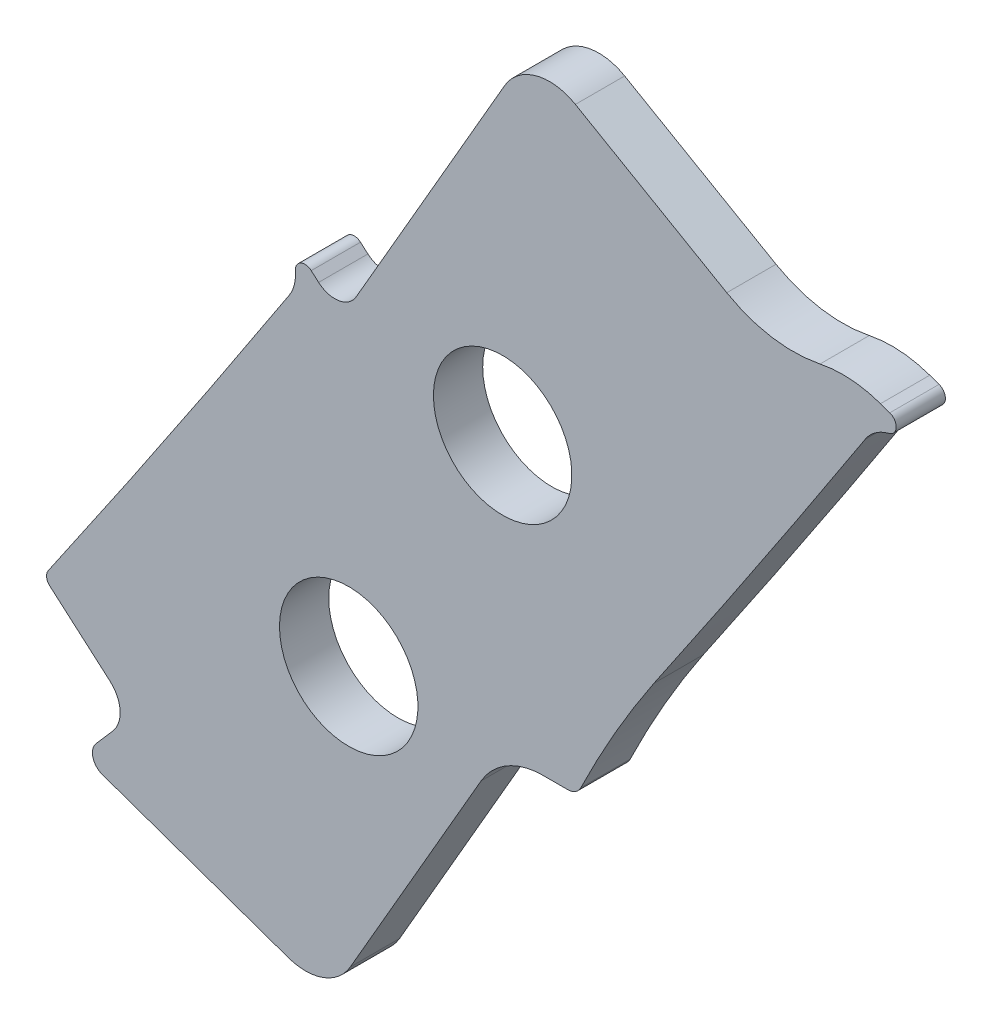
SolidWorks part; units mm, degrees
ref_plane "Front" through (0, 0, 0) normal (0, 0, 1) x (1, 0, 0)
ref_plane "Top" through (0, 0, 0) normal (0, 1, 0) x (1, 0, 0)
ref_plane "Right" through (0, 0, 0) normal (1, 0, 0) x (0, 0, -1)
sketch "Sketch1" plane through (0, 0, 0) normal (0, 0, 1) x (1, 0, 0)
  line L18 (-1062.7125, 28.4504) -> (-1063.1916, 28.6192)
  line L19 (-1071.1191, 29.6103) -> (-1078.9233, 34.116)
  line L20 (-1082.5664, 33.1398) -> (-1090.2276, 19.8704)
  line L21 (-1092.1626, 19.5486) -> (-1092.5453, 19.8827)
  line L22 (-1106.0208, -0.9414) -> (-1102.9205, -3.6338)
  line L23 (-1102.7691, -5.7838) -> (-1103.6391, -6.7855)
  line L24 (-1103.3171, -8.0038) -> (-1093.7255, -11.3845)
  line L25 (-1090.5293, -10.2027) -> (-1083.7857, 1.4776)
  line L26 (-1080.5961, 3.3191) -> (-1079.3261, 3.3191)
  line L27 (-1062.7125, 28.4504) -> (-1063.1916, 28.6192)
  line L28 (-1071.1191, 29.6103) -> (-1078.9233, 34.116)
  line L29 (-1082.5664, 33.1398) -> (-1090.2276, 19.8704)
  line L30 (-1092.1626, 19.5486) -> (-1092.5453, 19.8827)
  line L31 (-1106.0208, -0.9414) -> (-1102.9205, -3.6338)
  line L32 (-1102.7691, -5.7838) -> (-1103.6391, -6.7855)
  line L33 (-1103.3171, -8.0038) -> (-1093.7255, -11.3845)
  line L34 (-1090.5293, -10.2027) -> (-1083.7857, 1.4776)
  line L35 (-1080.5961, 3.3191) -> (-1079.3261, 3.3191)
  arc A34 (-1079.3261, 3.3191) -> (-1078.6407, 3.748) centre (-1079.3261, 4.0811) ccw
  arc A35 (-1074.8713, 10.2959) -> (-1078.6407, 3.748) centre (-1030.0901, -19.8428) ccw
  arc A36 (-1074.8713, 10.2959) -> (-1063.9737, 26.6436) centre (-1773.1695, 487.596) ccw
  arc A37 (-1062.7579, 27.5087) -> (-1063.9737, 26.6436) centre (-1062.2699, 25.5362) ccw
  arc A38 (-1062.7579, 27.5087) -> (-1062.7125, 28.4504) centre (-1062.876, 27.9863) ccw
  arc A39 (-1063.1916, 28.6192) -> (-1066.3096, 28.8319) centre (-1065.1336, 23.1095) ccw
  arc A40 (-1071.1191, 29.6103) -> (-1066.3096, 28.8319) centre (-1067.6901, 35.5495) ccw
  arc A41 (-1078.9233, 34.116) -> (-1082.5664, 33.1398) centre (-1080.2568, 31.8063) ccw
  arc A42 (-1092.1626, 19.5486) -> (-1090.2276, 19.8704) centre (-1091.3274, 20.5054) ccw
  arc A43 (-1092.5453, 19.8827) -> (-1093.3595, 19.4748) centre (-1092.8689, 19.5121) ccw
  arc A44 (-1093.6839, 18.2104) -> (-1093.3595, 19.4748) centre (-1095.3856, 19.321) ccw
  arc A45 (-1106.1031, -0.2905) -> (-1093.6839, 18.2104) centre (-1812.9205, 487.596) ccw
  arc A46 (-1106.1031, -0.2905) -> (-1106.0208, -0.9414) centre (-1105.6982, -0.57) ccw
  arc A47 (-1102.7691, -5.7838) -> (-1102.9205, -3.6338) centre (-1103.9198, -4.7845) ccw
  arc A48 (-1103.6391, -6.7855) -> (-1103.3171, -8.0038) centre (-1103.0637, -7.2851) ccw
  arc A49 (-1093.7255, -11.3845) -> (-1090.5293, -10.2027) centre (-1092.8389, -8.8692) ccw
  arc A50 (-1080.5961, 3.3191) -> (-1083.7857, 1.4776) centre (-1080.5961, -0.3639) ccw
  arc A51 (-1079.3261, 3.3191) -> (-1078.6407, 3.748) centre (-1079.3261, 4.0811) ccw
  arc A52 (-1074.8713, 10.2959) -> (-1078.6407, 3.748) centre (-1030.0901, -19.8428) ccw
  arc A53 (-1074.8713, 10.2959) -> (-1063.9737, 26.6436) centre (-1773.1695, 487.596) ccw
  arc A54 (-1062.7579, 27.5087) -> (-1063.9737, 26.6436) centre (-1062.2699, 25.5362) ccw
  arc A55 (-1062.7579, 27.5087) -> (-1062.7125, 28.4504) centre (-1062.876, 27.9863) ccw
  arc A56 (-1063.1916, 28.6192) -> (-1066.3096, 28.8319) centre (-1065.1336, 23.1095) ccw
  arc A57 (-1071.1191, 29.6103) -> (-1066.3096, 28.8319) centre (-1067.6901, 35.5495) ccw
  arc A58 (-1078.9233, 34.116) -> (-1082.5664, 33.1398) centre (-1080.2568, 31.8063) ccw
  arc A59 (-1092.1626, 19.5486) -> (-1090.2276, 19.8704) centre (-1091.3274, 20.5054) ccw
  arc A60 (-1092.5453, 19.8827) -> (-1093.3595, 19.4748) centre (-1092.8689, 19.5121) ccw
  arc A61 (-1093.6839, 18.2104) -> (-1093.3595, 19.4748) centre (-1095.3856, 19.321) ccw
  arc A62 (-1106.1031, -0.2905) -> (-1093.6839, 18.2104) centre (-1812.9205, 487.596) ccw
  arc A63 (-1106.1031, -0.2905) -> (-1106.0208, -0.9414) centre (-1105.6982, -0.57) ccw
  arc A64 (-1102.7691, -5.7838) -> (-1102.9205, -3.6338) centre (-1103.9198, -4.7845) ccw
  arc A65 (-1103.6391, -6.7855) -> (-1103.3171, -8.0038) centre (-1103.0637, -7.2851) ccw
  arc A66 (-1093.7255, -11.3845) -> (-1090.5293, -10.2027) centre (-1092.8389, -8.8692) ccw
  arc A67 (-1080.5961, 3.3191) -> (-1083.7857, 1.4776) centre (-1080.5961, -0.3639) ccw
  dimension "D1" = 0.508
extrude "Boss-Extrude1" add sketch "Sketch1" against normal blind 2.54 separate body
hole_wizard "Hole1" positions "Point_Sketch" profile "Profil_Sketch" hole size "Ø0.15" standard "ISO"
sketch "Point_Sketch" plane through (-1077.4967, 28.0636, -2.54) normal (0, 0, 1) x (-1, 0, 0)
  point P0 (5.1783, 10.6011)
  point P2 (13.1158, 24.8886)
sketch "Profil_Sketch" plane through (-1082.675, 17.4625, -2.54) normal (1, 0, 0) x (0, 1, 0)
  line L0 (0, 0) -> (0, 2.54)
  line L1 (0, 2.54) -> (3.5687, 2.54)
  line L2 (3.5687, 2.54) -> (3.5687, 0)
  line L5 (3.5687, 0) -> (0, 0)
  line L11 (0, -6.35) -> (0, 107.95) construction
  dimension "Diameter" = 7.1374
  dimension "Thru Hole Depth" = 2.54
other "usin_DL090_.25-20x3-SHCS<1>"
